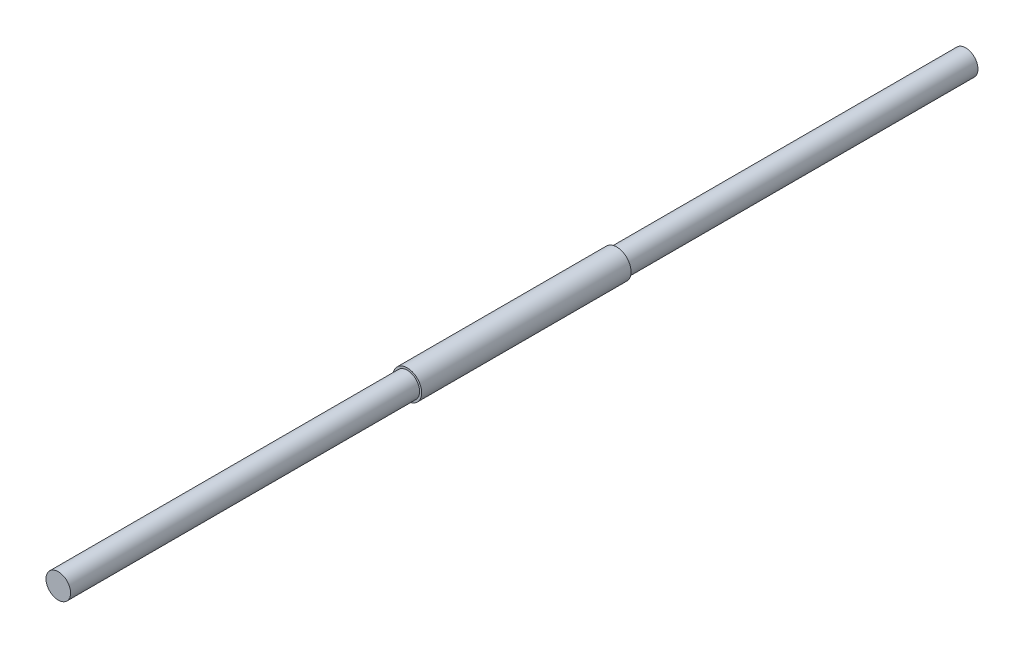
SolidWorks part; units mm, degrees
ref_plane "前视基准面" through (0, 0, 0) normal (0, 0, 1) x (1, 0, 0)
ref_plane "上视基准面" through (0, 0, 0) normal (0, 1, 0) x (1, 0, 0)
ref_plane "右视基准面" through (0, 0, 0) normal (1, 0, 0) x (0, 0, -1)
other "Configuration Table"
sketch "草图1" plane through (0, 0, 0) normal (0, 0, 1) x (1, 0, 0)
  circle A0 centre (0, 0) radius 3.5
  dimension "D1" = 7
extrude "凸台-拉伸1" add sketch "草图1" along normal mid plane 51
sketch "草图2" plane through (0, 0, 25.5) normal (0, 0, 1) x (1, 0, 0)
  circle A0 centre (0, 0) radius 3
  dimension "D1" = 6
extrude "凸台-拉伸2" add sketch "草图2" along normal blind 85
mirror "镜向1" about plane through (0, 0, 0) normal (0, 0, 1) of "凸台-拉伸2"
